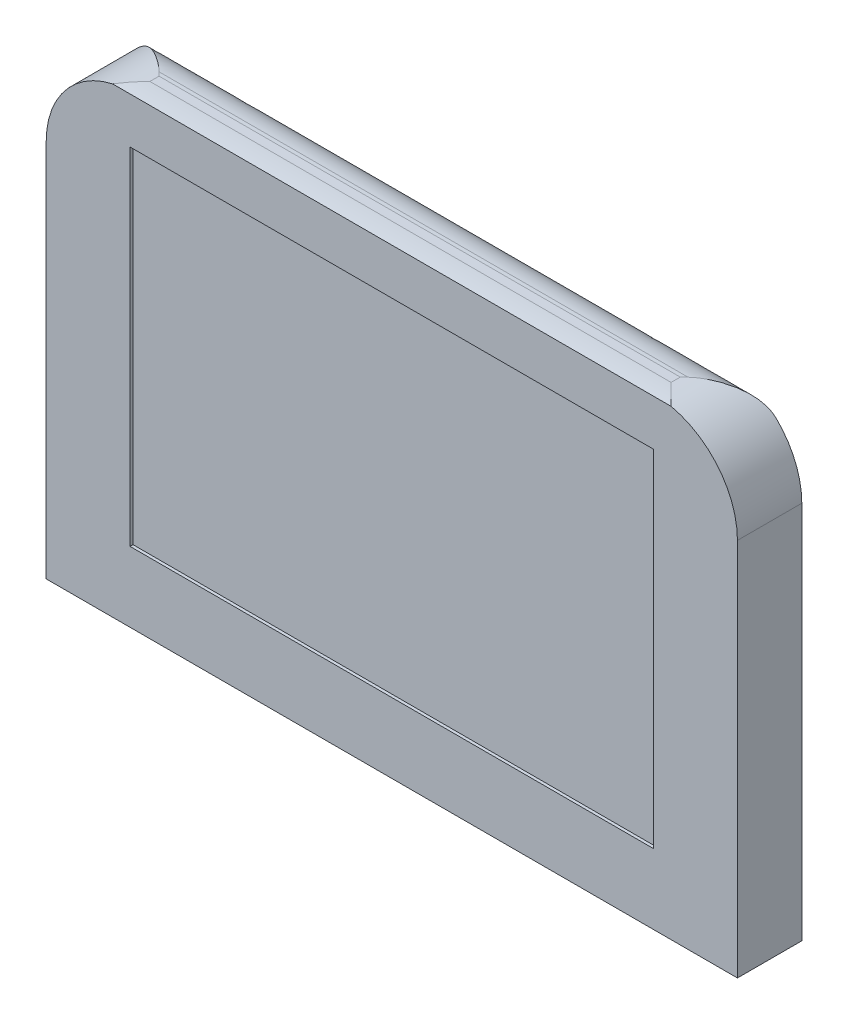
SolidWorks part; units mm, degrees
ref_plane "Front Plane" through (0, 0, 0) normal (0, 0, 1) x (1, 0, 0)
ref_plane "Top Plane" through (0, 0, 0) normal (0, 1, 0) x (1, 0, 0)
ref_plane "Right Plane" through (0, 0, 0) normal (1, 0, 0) x (0, 0, -1)
sketch "Sketch1" plane through (0, 0, 0) normal (0, 0, 1) x (1, 0, 0)
  line L1 (115.8875, -77.7875) -> (-115.8875, -77.7875)
  line L2 (115.8875, -77.7875) -> (115.8875, 77.7875)
  line L3 (115.8875, 77.7875) -> (-115.8875, 77.7875)
  line L4 (-115.8875, -77.7875) -> (-115.8875, 77.7875)
  line L5 (115.8875, -77.7875) -> (-115.8875, 77.7875) construction
  line L6 (115.8875, 77.7875) -> (-115.8875, -77.7875) construction
  point P0 (0, 0)
  dimension "D1" = 155.575
  dimension "D2" = 231.775
extrude "Extrude1" add sketch "Sketch1" along normal blind 21.58
sketch "Sketch2" plane through (0, 77.7875, 0) normal (0, 1, 0) x (1, 0, 0)
  line L0 (0, -21.58) -> (0, 0) construction
  line L1 (115.8875, -21.58) -> (-115.8875, -21.58) construction
  line L2 (115.8875, 0) -> (-115.8875, 0) construction
  line L3 (115.8875, -10.79) -> (-115.8875, -10.79) construction
  line L4 (115.8875, -21.58) -> (115.8875, 0) construction
  line L5 (-115.8875, -21.58) -> (-115.8875, 0) construction
  line L6 (0, 0) -> (-115.8875, 0) construction
  circle A0 centre (85.4114, -10.79) radius 5.6247
  point P14 (-57.9438, -10.79)
  point P16 (0, -10.79)
  point P17 (-57.9438, 0)
  point P18 (0, -7.79)
  point P19 (0, -3.79)
  point P20 (0, -11.8336)
  point P21 (0, -17.79)
  dimension "D2" = 7
  dimension "D3" = 3
  dimension "D4" = 7
sketch "Sketch4" plane through (0, 0, 21.58) normal (0, 0, 1) x (1, 0, 0)
  line L0 (0, 77.7875) -> (0, 0) construction
  line L1 (115.8875, 77.7875) -> (-115.8875, 77.7875) construction
  point P5 (0, 77.0928)
sketch "Sketch5" plane through (0, 0, 0) normal (0, 0, -1) x (-1, 0, 0)
  line L0 (0, 0) -> (0, 77.7875) construction
  point P4 (0, 67.7875)
  point P5 (0, 75.7875)
  point P6 (0, 73.7875)
  point P7 (0, 72.7875)
  point P8 (0, 71.7875)
  point P9 (0, 69.7875)
  dimension "D1" = 10
  dimension "D2" = 2
  dimension "D3" = 4
  dimension "D4" = 5
  dimension "D5" = 6
  dimension "D6" = 8
sketch3d "3DSketch1"
  line L0 (0, 77.0928, 21.58) -> (0, 83.2299, 21.58)
  line L1 (0, 83.2299, 21.58) -> (0, 83.2299, 0)
  line L2 (0, 67.7875, 0) -> (0, 83.2299, 0)
  spline S0 degree 3 poles (0, 77.0928, 21.58) (-0.0044, 77.9334, 19.9146) (0.013, 77.8347, 15.447) (-0.0225, 77.7107, 5.2034) (-0.0336, 73.9505, 0.4496) (0.0015, 69.9062, -0.0246) (0.0008, 69.0465, 0) (0, 67.7875, 0) knots 0 0 0 0 0.307991 0.403453 0.893373 0.959152 1 1 1 1
sketch "Sketch8" plane through (0, 0, 0) normal (1, 0, 0) x (0, 0, -1)
  line L0 (0, 67.7875) -> (0, 83.2299) construction
  line L2 (-21.58, 77.0928) -> (-21.58, 83.2299) construction
  line L3 (-21.58, 83.2299) -> (0, 83.2299) construction
  line L4 (0, 67.7875) -> (0, 83.2299)
  line L6 (-21.58, 77.0928) -> (-21.58, 83.2299)
  line L7 (-21.58, 83.2299) -> (0, 83.2299)
  spline S0 degree 3 poles (1703.46, -934.6762) (-75.2561, 81.4774) (-48.2171, 78.2313) (-5.2034, 77.7107) (-0.4496, 73.9505) (0.4129, 66.5949) (-2.5204, 58.2987) (47.6047, -1931.3846) knots -2.85795 -2.85795 -2.85795 -2.85795 0.307991 0.403453 0.893373 0.959152 1.488444 1.488444 1.488444 1.488444 only from (-21.58, 77.0928) to (0, 67.7875) construction
  spline S1 degree 3 poles (-21.58, 77.0928) (-19.9146, 77.9334) (-15.447, 77.8347) (-5.2034, 77.7107) (-0.4496, 73.9505) (0.0246, 69.9062) (0, 69.0465) (0, 67.7875) knots 0 0 0 0 0.307991 0.403453 0.893373 0.959152 1 1 1 1
extrude "Extrude3" cut sketch "Sketch8" against normal through all and the other way through all contours L6 S1 L4 L7
sketch "Sketch10" plane through (0, 0, 21.58) normal (0, 0, 1) x (1, 0, 0)
  line L0 (0, 77.7875) -> (0, 0) construction
  line L1 (87.7875, -54.2875) -> (-87.7875, -54.2875)
  line L2 (87.7875, -54.2875) -> (87.7875, 61.6928)
  line L3 (87.7875, 61.6928) -> (-87.7875, 61.6928)
  line L4 (-87.7875, -54.2875) -> (-87.7875, 61.6928)
  line L5 (87.7875, -54.2875) -> (-87.7875, 61.6928) construction
  line L6 (87.7875, 61.6928) -> (-87.7875, -54.2875) construction
  line L7 (-115.8875, 77.0928) -> (-115.8875, -77.7875) construction
  line L8 (-115.8875, 77.0928) -> (115.8875, 77.0928) construction
  line L9 (-115.8875, -77.7875) -> (115.8875, -77.7875) construction
  point P0 (0, 3.7027)
  dimension "D1" = 28.1
  dimension "D2" = 15.4
  dimension "D3" = 23.5
fillet "Fillet7" radius 28.5 4 edges at (0, 77.7875, 17.9189) (0, 77.7875, 11.8336) (115.8875, 77.7875, 14.8763) (-115.8875, 77.7875, 14.8763)
extrude "Extrude4" cut sketch "Sketch10" against normal blind 1
sketch "Sketch11" plane through (0, -77.7875, 0) normal (0, -1, 0) x (1, 0, 0)
  line L0 (0, 0) -> (0, 21.58) construction
  line L1 (-115.8875, 0) -> (115.8875, 0) construction
  line L2 (-115.8875, 21.58) -> (115.8875, 21.58) construction
  circle A0 centre (0, 10.79) radius 5
  dimension "D1" = 10
extrude "Extrude5" add sketch "Sketch11" along normal blind 0.5 separate body
